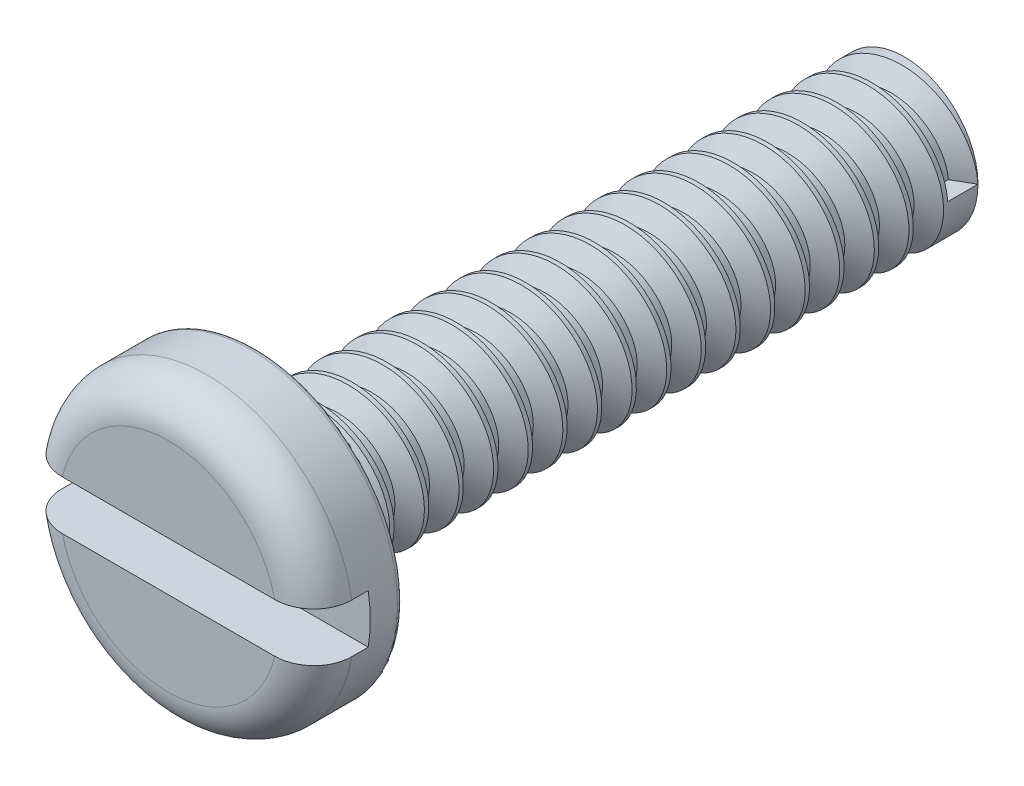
SolidWorks part; units mm, degrees
ref_plane "Front Plane" through (0, 0, 0) normal (0, 0, 1) x (1, 0, 0)
ref_plane "Top Plane" through (0, 0, 0) normal (0, 1, 0) x (1, 0, 0)
ref_plane "Right Plane" through (0, 0, 0) normal (1, 0, 0) x (0, 0, -1)
sketch "Sketch1" plane through (0, 0, 0) normal (0, 0, 1) x (1, 0, 0)
  circle A0 centre (0, 0) radius 2.7
  dimension "D1" = 5.4
extrude "Boss-Extrude1" add sketch "Sketch1" along normal blind 1.6
sketch "Sketch2" plane through (0, 0, 1.6) normal (0, 0, 1) x (1, 0, 0)
  line L1 (2.6622, 0.45) -> (-2.6622, 0.45)
  line L3 (2.6622, -0.45) -> (-2.6622, -0.45)
  line L5 (2.6622, 0.45) -> (-2.6622, -0.45) construction
  line L6 (2.6622, -0.45) -> (-2.6622, 0.45) construction
  circle A0 centre (0, 0) radius 2.7 construction
  arc A1 (-2.6622, 0.45) -> (-2.6622, -0.45) centre (0, 0) ccw
  arc A2 (2.6622, -0.45) -> (2.6622, 0.45) centre (0, 0) ccw
  point P0 (0, 0)
  dimension "D1" = 0.9
extrude "Cut-Extrude1" cut sketch "Sketch2" against normal blind 1
fillet "Fillet2" radius 0.7 2 edges at (0, 2.7, 1.6) (0, -2.7, 1.6)
fillet "Fillet3" radius 0.1 1 edges at (2.7, 0, 0)
sketch "Sketch3" plane through (0, 0, 0) normal (0, 0, -1) x (-1, 0, 0)
  circle A0 centre (0, 0) radius 1.35
  dimension "D1" = 2.7
extrude "Boss-Extrude2" add sketch "Sketch3" along normal blind 11.9
thread "Thread1" pitch 0.635 start angle 0, offset 0, length 11.6, pitch 0.635, diameter 2.7
ref_plane "Plane1" through (1.35, 0, -11.9) normal (0, -1, 0) x (1, 0, 0)
sketch "Thread Profile1" plane through (1.35, 0, -11.9) normal (0, -1, 0) x (1, 0, 0)
  line L0 (0, 0) -> (0, 0.635) construction
  line L11 (0, 0) -> (0, 0.5556)
  line L12 (0, 0.5556) -> (-0.3437, 0.3572)
  line L13 (-0.3437, 0.3572) -> (-0.3437, 0.1984)
  line L15 (-0.3437, 0.1984) -> (0, 0)
  line L17 (-0.3437, 0.2778) -> (0, 0.2778) construction
  point P2 (0, 0)
  dimension "Pitch" = 0.635
  dimension "Profile_Angle" = 60
  dimension "Profile_Land" = 0.1588
  dimension "Profile_Height" = 0.3437
